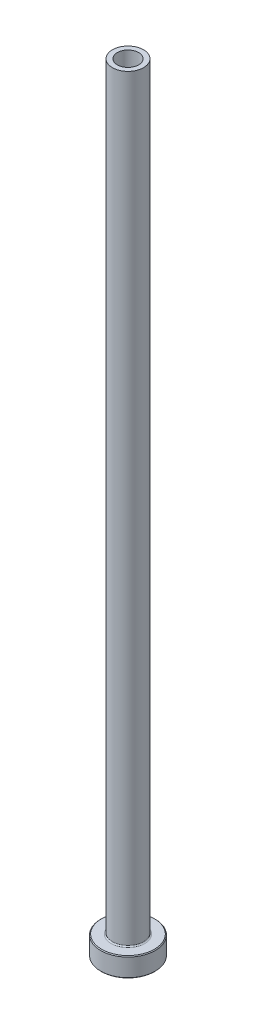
SolidWorks part; units mm, degrees
ref_plane "Front Plane" through (0, 0, 0) normal (0, 0, 1) x (1, 0, 0)
ref_plane "Top Plane" through (0, 0, 0) normal (0, 1, 0) x (1, 0, 0)
ref_plane "Right Plane" through (0, 0, 0) normal (1, 0, 0) x (0, 0, -1)
sketch "Sketch1" plane through (0, 0, 0) normal (0, 0, 1) x (1, 0, 0)
  line L0 (-2.75, 200) -> (-4, 200)
  line L1 (-4, 200) -> (-4, 5)
  line L2 (-4, 5) -> (-7, 5)
  line L3 (-7, 5) -> (-7, 0)
  line L4 (7.7, 0) -> (-7.7, 0) construction
  line L5 (-7, 0) -> (-3, 0)
  line L6 (-2.75, 155) -> (-2.75, 200)
  line L7 (0, 92.1877) -> (0, -15.5353) construction
  line L8 (0, -7.7) -> (0, 7.7) construction
  line L9 (-2.75, 155) -> (-3, 143)
  line L10 (-3, 143) -> (-3, 0)
  dimension "D1" = 0.25
  dimension "ID" = 5.5
  dimension "OD" = 8
  dimension "L" = 200
  dimension "H" = 14
  dimension "T" = 5
  dimension "N" = 45
  dimension "D2" = 12
revolve "Revolve1" add sketch "Sketch1" angle 360 about L7
fillet "Fillet1" radius 0.3 1 edges at (0, 5, 4)
chamfer "Chamfer1" distance 0.2 angle 45 2 edges at (0, 5, 7) (0, 0, 7)
chamfer "Chamfer3" distance 0.5 angle 45 1 edges at (0, 0, 3)
